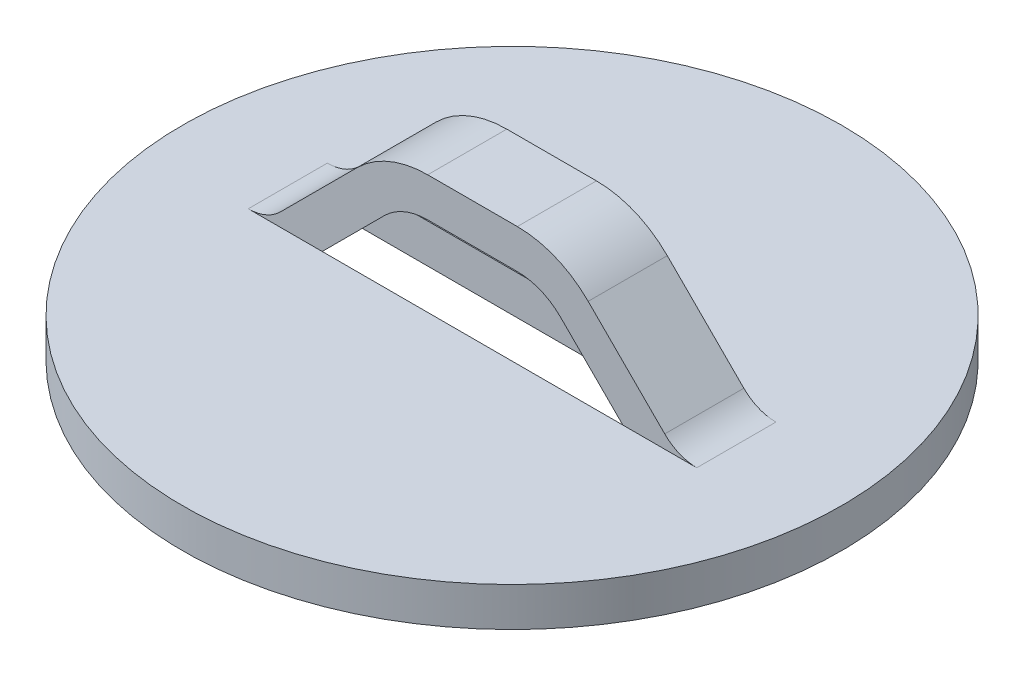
SolidWorks part; units mm, degrees
ref_plane "Front Plane" through (0, 0, 0) normal (0, 0, 1) x (1, 0, 0)
ref_plane "Top Plane" through (0, 0, 0) normal (0, 1, 0) x (1, 0, 0)
ref_plane "Right Plane" through (0, 0, 0) normal (1, 0, 0) x (0, 0, -1)
sketch "Sketch1" plane through (0, 0, 0) normal (0, 0, 1) x (1, 0, 0)
  line L0 (-16.6885, 0) -> (-11.6167, 0)
  line L1 (-0.8135, 0) -> (-0.8135, -11.7731) construction
  line L2 (-2.9725, 5.7404) -> (1.3455, 5.7404)
  line L3 (-10.072, 0.6398) -> (-6.3849, 4.3269)
  line L4 (8.4451, 0.6398) -> (4.758, 4.3269)
  line L5 (9.9898, 0) -> (15.0615, 0)
  line L6 (-16.6885, -1.8796) -> (-11.6167, -1.8796)
  line L7 (-8.743, -0.6893) -> (-5.0559, 2.9978)
  line L8 (-2.9725, 3.8608) -> (1.3455, 3.8608)
  line L9 (7.1161, -0.6893) -> (3.429, 2.9978)
  line L10 (9.9898, -1.8796) -> (15.0615, -1.8796)
  line L11 (-16.6885, 0) -> (-16.6885, -1.8796)
  line L12 (15.0615, 0) -> (15.0615, -1.8796)
  arc A1 (1.3455, 5.7404) -> (4.758, 4.3269) centre (1.3455, 0.9144) cw
  arc A2 (-2.9725, 5.7404) -> (-6.3849, 4.3269) centre (-2.9725, 0.9144) ccw
  arc A3 (-10.072, 0.6398) -> (-11.6167, 0) centre (-11.6167, 2.1844) cw
  arc A4 (8.4451, 0.6398) -> (9.9898, 0) centre (9.9898, 2.1844) ccw
  arc A5 (-8.743, -0.6893) -> (-11.6167, -1.8796) centre (-11.6167, 2.1844) cw
  arc A6 (-2.9725, 3.8608) -> (-5.0559, 2.9978) centre (-2.9725, 0.9144) ccw
  arc A7 (1.3455, 3.8608) -> (3.429, 2.9978) centre (1.3455, 0.9144) cw
  arc A8 (7.1161, -0.6893) -> (9.9898, -1.8796) centre (9.9898, 2.1844) ccw
  point P11 (3.3445, 5.7404)
  point P14 (-4.9714, 5.7404)
  point P19 (9.0849, 0)
  dimension "D4" = 4.826
  dimension "D6" = 2.1844
  dimension "D1" = 31.75
  dimension "D2" = 5.7404
  dimension "D3" = 45
  dimension "D5" = 4.318
  dimension "D7" = 1.8796
extrude "Boss-Extrude1" add sketch "Sketch1" along normal blind 3.81
sketch "Sketch2" plane through (0, -1.8796, 0) normal (0, -1, 0) x (1, 0, 0)
  line L0 (-0.8135, 3.81) -> (-0.8135, 0) construction
  line L1 (-2.9725, 3.81) -> (1.3455, 3.81) construction
  line L2 (-2.9725, 0) -> (1.3455, 0) construction
  line L4 (-11.6167, 0) -> (9.9898, 0)
  line L5 (-11.6167, 0) -> (-11.6167, 3.81)
  line L6 (-11.6167, 3.81) -> (9.9898, 3.81)
  line L7 (9.9898, 0) -> (9.9898, 3.81)
  line L8 (-11.6167, 0) -> (9.9898, 3.81) construction
  line L9 (-11.6167, 3.81) -> (9.9898, 0) construction
  circle A0 centre (-0.8135, 1.905) radius 15.875
  point P6 (-0.8135, 1.905)
extrude "Boss-Extrude2" add sketch "Sketch2" against normal up to vertex
other "DeleteFace1"
